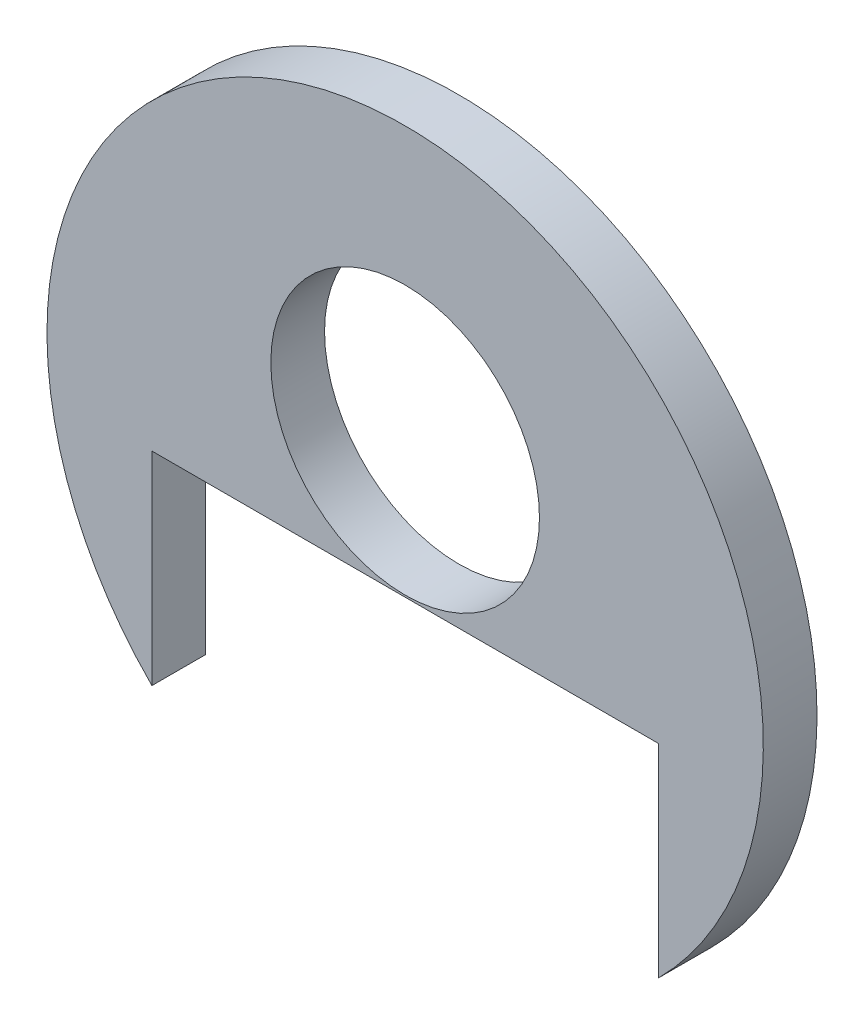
SolidWorks part; units mm, degrees
ref_plane "Front Plane" through (0, 0, 0) normal (0, 0, 1) x (1, 0, 0)
ref_plane "Top Plane" through (0, 0, 0) normal (0, 1, 0) x (1, 0, 0)
ref_plane "Right Plane" through (0, 0, 0) normal (1, 0, 0) x (0, 0, -1)
sketch "Sketch1" plane through (0, 0, 0) normal (0, 0, 1) x (1, 0, 0)
  circle A0 centre (0, 0) radius 25.4
  dimension "D1" = 50.8
extrude "Extrude1" add sketch "Sketch1" against normal blind 3.81
sketch "Sketch2" plane through (0, 0, 0) normal (0, 0, 1) x (1, 0, 0)
  circle A0 centre (0, 6.096) radius 9.525
  dimension "D1" = 19.05
  dimension "D2" = 6.096
extrude "Cut-Extrude1" cut sketch "Sketch2" against normal through all
sketch "Sketch3" plane through (0, 0, 0) normal (0, 0, 1) x (1, 0, 0)
  line L0 (-28.627, 0) -> (27.711, 0) construction
  line L1 (0, 6.096) -> (-28.627, 6.096) construction
  line L2 (-17.9578, -3.556) -> (17.9578, -3.556)
  line L3 (0, 27.9782) -> (0, -25.4) construction
  line L4 (-17.9578, -3.556) -> (-17.9578, -28.1052)
  line L5 (-17.9578, -28.1052) -> (17.9578, -28.1052)
  line L6 (17.9578, -28.1052) -> (17.9578, -3.556)
  circle A0 centre (0, 0) radius 25.4 construction
  dimension "D1" = 35.9156
  dimension "D2" = 17.9578
  dimension "D3" = 9.652
extrude "Cut-Extrude10" cut sketch "Sketch3" against normal through all
